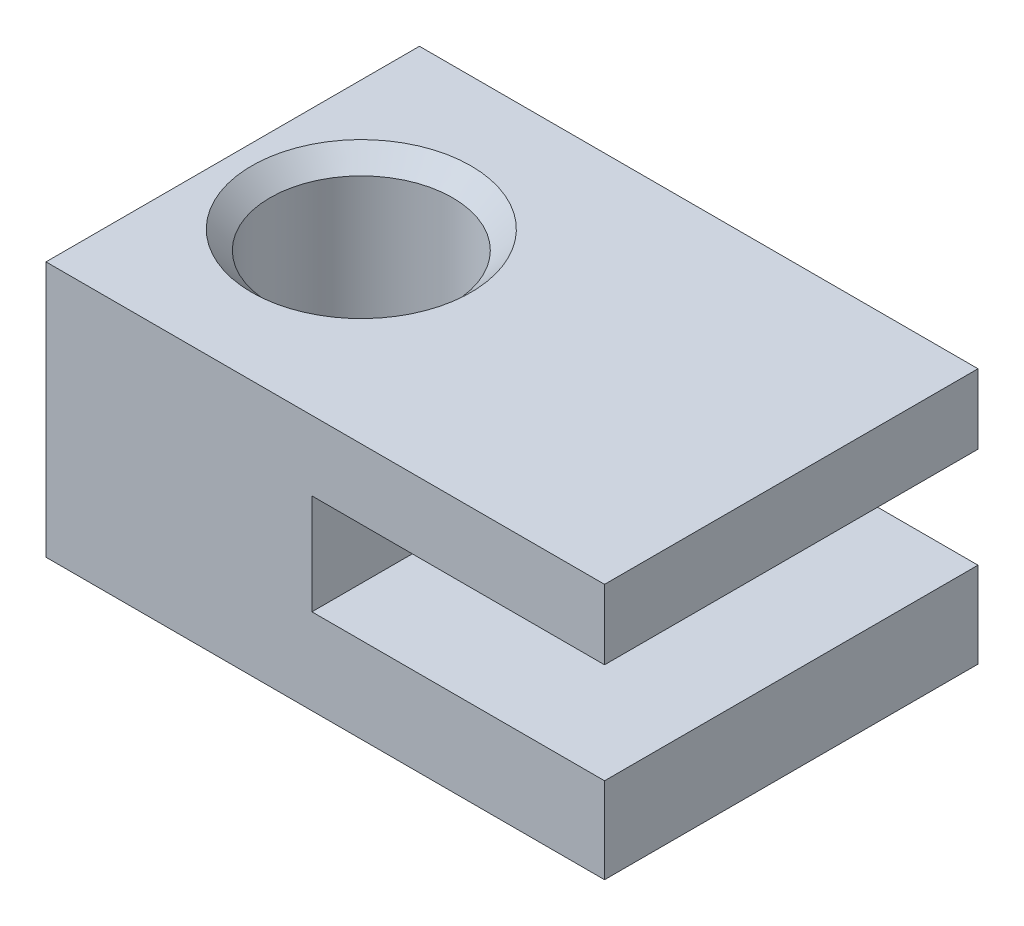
SolidWorks part; units mm, degrees
ref_plane "Front Plane" through (0, 0, 0) normal (0, 0, 1) x (1, 0, 0)
ref_plane "Top Plane" through (0, 0, 0) normal (0, 1, 0) x (1, 0, 0)
ref_plane "Right Plane" through (0, 0, 0) normal (1, 0, 0) x (0, 0, -1)
sketch "Sketch1" plane through (0, 0, 0) normal (0, 1, 0) x (1, 0, 0)
  line L1 (-63.6576, 44.2683) -> (90.5104, 44.2683)
  line L2 (-63.6576, 44.2683) -> (-63.6576, -58.8041)
  line L3 (-63.6576, -58.8041) -> (90.5104, -58.8041)
  line L4 (90.5104, 44.2683) -> (90.5104, -58.8041)
extrude "Extruir1" add sketch "Sketch1" along normal blind 70.612
sketch "Sketch2" plane through (0, 0, 58.8041) normal (0, 0, 1) x (1, 0, 0)
  line L1 (93.7683, 51.3744) -> (9.741, 51.3744)
  line L2 (93.7683, 51.3744) -> (93.7683, 23.6601)
  line L3 (93.7683, 23.6601) -> (9.741, 23.6601)
  line L4 (9.741, 51.3744) -> (9.741, 23.6601)
extrude "Corte1" cut sketch "Sketch2" against normal through all
sketch "Sketch3" plane through (0, 70.612, 0) normal (0, 1, 0) x (-1, 0, 0)
  circle A0 centre (27.9716, 7.4587) radius 25.1822
extrude "Corte2" cut sketch "Sketch3" against normal through all
chamfer "Chaflan1" distance 5.08 angle 45 1 edges at (-27.9716, 70.612, 32.6409)
